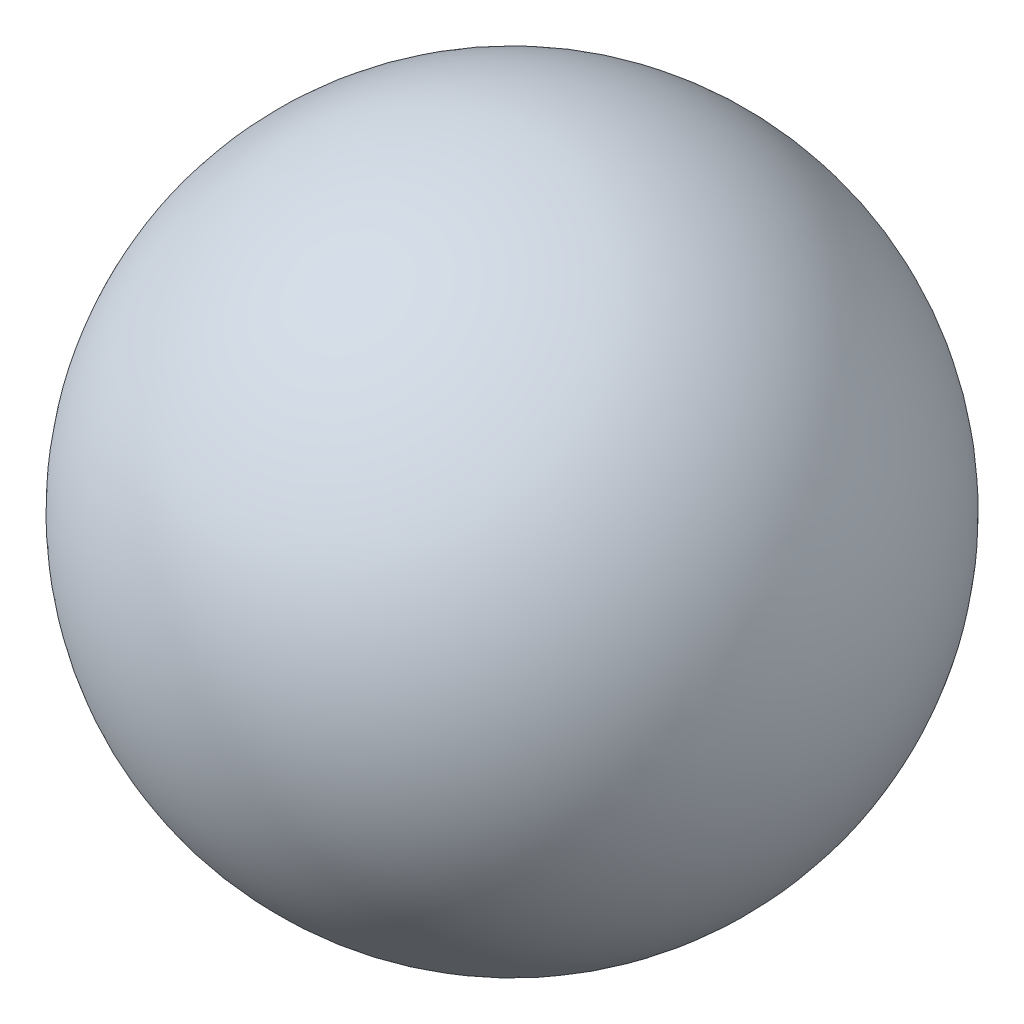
SolidWorks part; units mm, degrees
ref_plane "Plan1" through (0, 0, 0) normal (0, 0, 1) x (1, 0, 0)
ref_plane "Plan2" through (0, 0, 0) normal (0, 1, 0) x (1, 0, 0)
ref_plane "Plan3" through (0, 0, 0) normal (1, 0, 0) x (0, 0, -1)
sketch "Esquisse1" plane through (0, 0, 0) normal (0, 1, 0) x (1, 0, 0)
  line L1 (-0.3, 5.2) -> (11.7, 5.2) construction
  line L2 (-0.3, 10.4) -> (-0.3, 0) construction
  line L3 (11.7, 10.4) -> (11.7, 0) construction
  line L4 (2.4, 5.2) -> (9, 5.2)
  circle A1 centre (5.7, 5.2) radius 3.3 construction
  arc A2 (9, 5.2) -> (2.4, 5.2) centre (5.7, 5.2) ccw
revolve "Base-Révolution" add sketch "Esquisse1" angle 360 about L1
